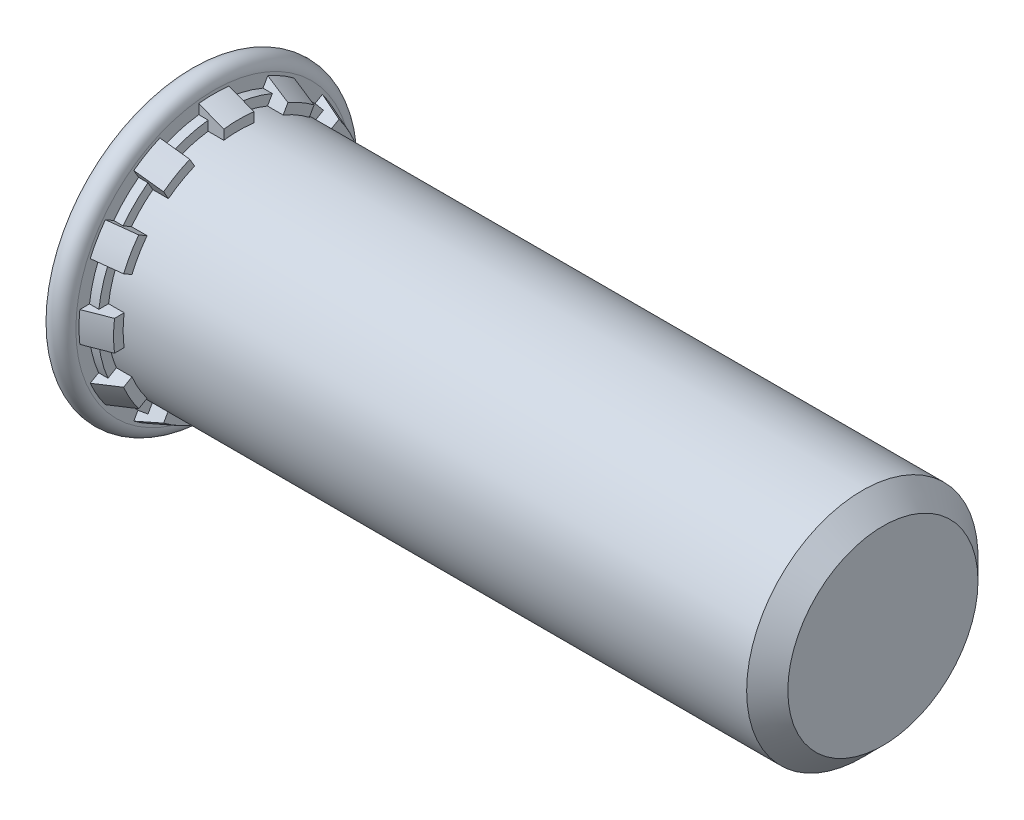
SolidWorks part; units mm, degrees
ref_plane "Plane1" through (0, 0, 0) normal (0, 0, 1) x (1, 0, 0)
ref_plane "Plane2" through (0, 0, 0) normal (0, 1, 0) x (1, 0, 0)
ref_plane "Plane3" through (0, 0, 0) normal (1, 0, 0) x (0, 0, -1)
sketch "BodySke" plane through (0, 0, 0) normal (0, 0, 1) x (1, 0, 0)
  line L0 (0, 0) -> (0, 2.9775)
  line L1 (0.54, 2.9825) -> (0.54, 2.915)
  line L2 (0.54, 2.915) -> (1.08, 2.7075)
  line L3 (1.08, 2.5) -> (14.555, 2.5)
  line L4 (15, 2.055) -> (15, 0)
  line L5 (15, 0) -> (0, 0)
  line L6 (0, 0) -> (50.554, 0) construction
  line L7 (1.08, 2.7075) -> (1.08, 2.5)
  line L8 (15, 2.055) -> (14.555, 2.5)
  line L9 (-9.525, 3.25) -> (9.525, 3.25) construction
  line L11 (1.88, 19.05) -> (1.88, -3.175) construction
  line L13 (9.525, -3.25) -> (-9.525, -3.25) construction
  line L14 (0.0051, 2.9825) -> (0.0051, 2.9775)
  line L15 (0, 2.9775) -> (0.0051, 2.9775)
  arc A0 (0.0051, 2.9825) -> (0.54, 2.9825) centre (0.2725, 2.9825) cw
  dimension "D2" = 0.0051
  dimension "D1" = 0.0051
  dimension "Diameter" = 5
  dimension "Length" = 15
  dimension "Body_ch_ang" = 45
  dimension "Minor_dia" = 4.11
  dimension "Advance" = 0.8
  dimension "H_dia" = 6.5
  dimension "Shoulder_lower_dia" = 5.83
  dimension "Shoulder_upper_dia" = 5.415
  dimension "Shoulder_ht" = 1.08
  dimension "T_dim" = 0.54
revolve "BaseBody" add sketch "BodySke" angle 360 about L6
sketch "ThdSchSke" plane through (0, 0, 0) normal (0, 0, 1) x (1, 0, 0)
  line L0 (2.7, -2.055) -> (2.3884, -2.5)
  line L1 (2.7, -2.055) -> (3.0116, -2.5)
  line L2 (3.0116, -2.5) -> (3.0116, -3.125)
  line L3 (-3.175, 0) -> (5.1513, 0) construction
  line L5 (3.0116, -3.125) -> (2.3884, -3.125)
  line L6 (2.3884, -3.125) -> (2.3884, -2.5)
  line L7 (0, 2.9775) -> (0, -2.9775) construction
  dimension "Thread_minor" = 4.11
  dimension "Diameter" = 5
  dimension "Start" = 2.7
  dimension "SideAngle" = 55
  dimension "VeeAngle" = 70
  dimension "Overcut" = 6.25
revolve "ThreadSchematic" [suppressed] cut sketch "ThdSchSke" angle 360 about L3
pattern_linear "ThdSchPat" [suppressed]
sketch "RibCut1Ske" plane through (1.08, 0, 0) normal (1, 0, 0) x (0, 0, -1)
  line L0 (0.3263, 2.4786) -> (0.3263, 3.2336)
  line L1 (0.9567, 2.3097) -> (1.3342, 2.9635)
  line L2 (0, 0) -> (0, 4.9784) construction
  line L3 (0, 0) -> (0.3263, 2.4786) construction
  line L4 (0, 0) -> (0.9567, 2.3097) construction
  arc A1 (0.9567, 2.3097) -> (0.3263, 2.4786) centre (0, 0) ccw
  arc A2 (1.3342, 2.9635) -> (0.3263, 3.2336) centre (0, 0) ccw
  dimension "Inner_dia" = 5
  dimension "Outer_dia" = 6.5
  dimension "Rib_root_half_angle" = 7.5
  dimension "Rib_root_gap_angle" = 15
  dimension "Angle" = 30
extrude "RibCut1" cut sketch "RibCut1Ske" against normal blind 0.3375
sketch "RibCut2Ske" plane through (1.08, 0, 0) normal (1, 0, 0) x (0, 0, -1)
  line L0 (0.3263, 2.6878) -> (0.3263, 3.2336)
  line L1 (1.0613, 2.4908) -> (1.3342, 2.9635)
  line L2 (0.3263, 2.4786) -> (0.3263, 4.2904) construction
  line L3 (0, 0) -> (0, 5.0239) construction
  line L4 (0, 0) -> (0.3263, 2.4786) construction
  line L5 (0, 0) -> (0.9567, 2.3097) construction
  line L6 (0.9567, 2.3097) -> (1.8661, 3.8849) construction
  arc A1 (1.0613, 2.4908) -> (0.3263, 2.6878) centre (0, 0) ccw
  arc A2 (1.3342, 2.9635) -> (0.3263, 3.2336) centre (0, 0) ccw
  circle A4 centre (0, 0) radius 2.5 construction
  dimension "Inner_dia" = 5.415
  dimension "Outer_dia" = 6.5
  dimension "Rib_root_dia" = 5
  dimension "Rib_root_half_angle" = 7.5
  dimension "Rib_root_gap_angle" = 15
  dimension "Angle" = 30
extrude "RibCut2" cut sketch "RibCut2Ske" against normal blind 0.54
pattern_circular "RibCutsPat" count 12 every 30 about axis through (0, 0, 0) along (1, 0, 0) of "RibCut2", "RibCut1"
equation "' \"Length@BodySke\" = 18"
equation "' \"H_dia@BodySke\" = 8.2"
equation "' \"Start@ThdSchSke\" = 3"
equation "' \"Diameter@BodySke\" = 6"
equation "' \"Minor_dia@BodySke\" = 4.819"
equation "' \"Advance@BodySke\" = 1"
equation "\"T_dim@BodySke\" = \"Start@ThdSchSke\" * 0.2"
equation "\"Shoulder_ht@BodySke\" = \"Start@ThdSchSke\" * 0.4"
equation "\"Shoulder_lower_dia@BodySke\" = \"H_dia@BodySke\" - \"Start@ThdSchSke\" * 0.2 - .13"
equation "\"Shoulder_upper_dia@BodySke\" = ( \"Shoulder_lower_dia@BodySke\" + \"Diameter@BodySke\" ) /2"
equation "\"Num_ribs@RibCutsPat\" = 12"
equation "\"Angle@RibCutsPat\" = 360 / \"Num_ribs@RibCutsPat\""
equation "\"Angle@RibCut1Ske\" =\"Angle@RibCutsPat\""
equation "\"Rib_root_half_angle@RibCut1Ske\" = \"Angle@RibCut1Ske\" / 4"
equation "\"Rib_root_gap_angle@RibCut1Ske\" = \"Angle@RibCut1Ske\" - (2 * \"Rib_root_half_angle@RibCut1Ske\" )"
equation "\"Inner_dia@RibCut1Ske\" = \"Diameter@BodySke\""
equation "\"Outer_dia@RibCut1Ske\" = \"H_dia@BodySke\""
equation "\"Depth@RibCut1\" =  \"Start@ThdSchSke\" * 0.125"
equation "\"Angle@RibCut2Ske\" =\"Angle@RibCutsPat\""
equation "\"Rib_root_half_angle@RibCut2Ske\" = \"Angle@RibCut1Ske\" / 4"
equation "\"Rib_root_gap_angle@RibCut2Ske\" = \"Angle@RibCut1Ske\" - (2 * \"Rib_root_half_angle@RibCut1Ske\" )"
equation "\"Rib_root_dia@RibCut2Ske\" = \"Diameter@BodySke\""
equation "\"Inner_dia@RibCut2Ske\" = \"Shoulder_upper_dia@BodySke\""
equation "\"Outer_dia@RibCut2Ske\" = \"H_dia@BodySke\""
equation "\"Depth@RibCut2\" =  \"Start@ThdSchSke\" * 0.2"
equation "\"Thread_length@ThreadCosmetic\" = \"Length@BodySke\" - \"Start@ThdSchSke\""
equation "\"Thread_minor@ThreadCosmetic\" = \"Minor_dia@BodySke\""
equation "\"Thread_minor@ThdSchSke\" = \"Minor_dia@BodySke\""
equation "\"Diameter@ThdSchSke\" = \"Diameter@BodySke\""
equation "\"Overcut@ThdSchSke\" = \"Diameter@BodySke\" * 1.25"
equation "\"Num_threads@ThdSchPat\" = int( \"Thread_length@ThreadCosmetic\" / \"Advance@BodySke\" + 0.999 )  + 1"
equation "\"Advance@ThdSchPat\" = \"Thread_length@ThreadCosmetic\" /  (\"Num_threads@ThdSchPat\" - 1) 'relax it"
equation "\"Num_threads@ThdSchPat\" = \"Num_threads@ThdSchPat\" - sgn( \"Num_threads@ThdSchPat\" - 1) '---chamfered tips only---"
